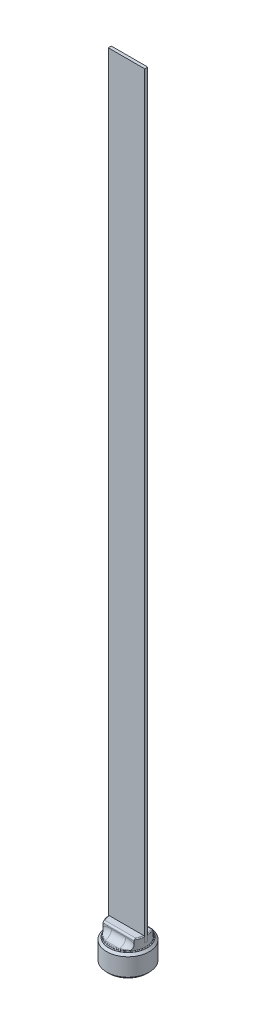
SolidWorks part; units mm, degrees
ref_plane "Front Plane" through (0, 0, 0) normal (0, 0, 1) x (1, 0, 0)
ref_plane "Top Plane" through (0, 0, 0) normal (0, 1, 0) x (1, 0, 0)
ref_plane "Right Plane" through (0, 0, 0) normal (1, 0, 0) x (0, 0, -1)
imported_body "Imported1"
sketch "Sketch1" plane through (0, 20.828, 0) normal (0, 1, 0) x (1, 0, 0)
  line L0 (14.0347, 1.1811) -> (-14.0347, 1.1811) construction
  line L1 (14.1749, 1.1811) -> (-14.1749, 1.1811)
  line L3 (14.1749, -1.1811) -> (-14.1749, -1.1811)
  line L5 (0, -1.1811) -> (0, 1.1811) construction
  line L6 (14.224, 0) -> (-14.224, 0) construction
  line L7 (-14.0347, -1.1811) -> (14.0347, -1.1811) construction
  arc A0 (-14.1749, 1.1811) -> (-14.1749, -1.1811) centre (0, 0) ccw
  arc A1 (14.1749, -1.1811) -> (14.1749, 1.1811) centre (0, 0) ccw
  dimension "D1" = 28.448
extrude "Boss-Extrude1" add sketch "Sketch1" along normal offset from surface (588.772 mm away) 609.6
